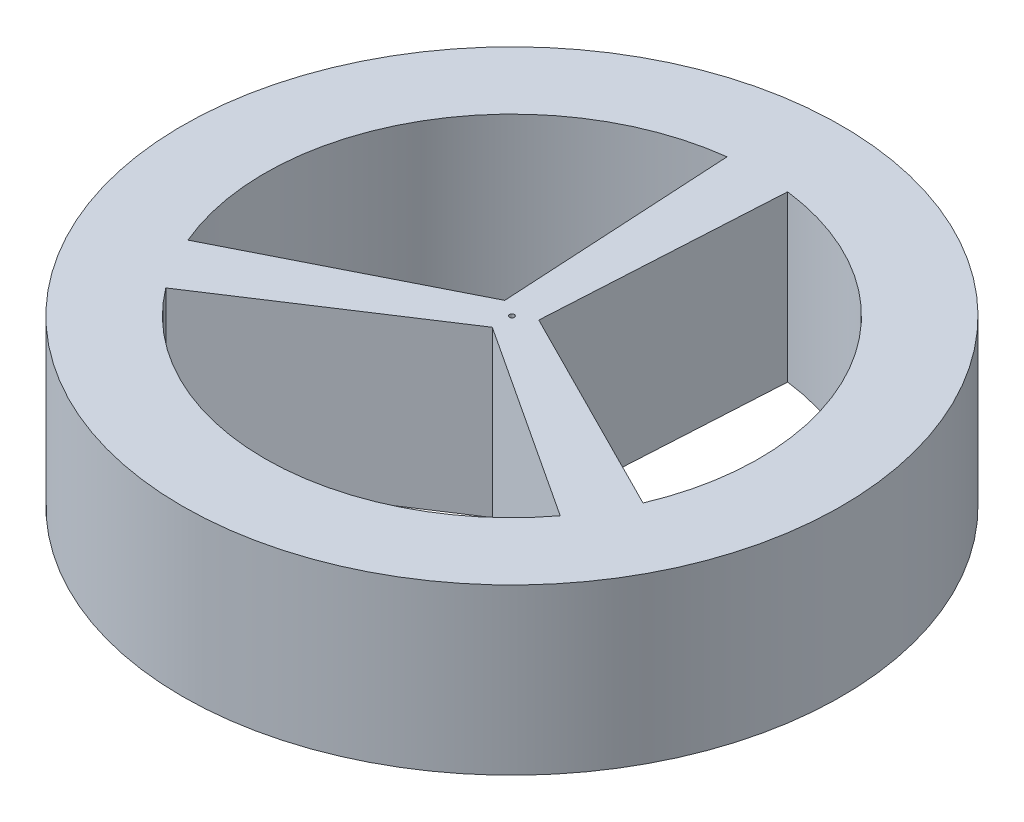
SolidWorks part; units mm, degrees
ref_plane "Plan de face" through (0, 0, 0) normal (0, 0, 1) x (1, 0, 0)
ref_plane "Plan de dessus" through (0, 0, 0) normal (0, 1, 0) x (1, 0, 0)
ref_plane "Plan de droite" through (0, 0, 0) normal (1, 0, 0) x (0, 0, -1)
sketch "Esquisse1" plane through (0, 0, 0) normal (0, 1, 0) x (1, 0, 0)
  line L0 (1.8429, 14.8864) -> (1, 0)
  line L1 (-1.834, 14.8875) -> (-1, 0)
  line L2 (13.8099, -5.8554) -> (0.5, 0.866)
  line L3 (11.9705, -9.0391) -> (-0.5, -0.866)
  line L4 (-11.9759, -9.032) -> (0.5, -0.866)
  line L5 (-13.8134, -5.8472) -> (-0.5, 0.866)
  circle A0 centre (0, 0) radius 20
  circle A1 centre (0, 0) radius 15
  circle A2 centre (0, 0) radius 0.15
  circle A3 centre (0, 0) radius 1
  arc A4 (-1.834, 14.8875) -> (1.8429, 14.8864) centre (0, 0) cw
  arc A5 (-1, 0) -> (1, 0) centre (0, 0) ccw
  point P21 (0, 0)
  dimension "D1" = 30
  dimension "D2" = 40
  dimension "D3" = 0.3
  dimension "D4" = 2
  dimension "D5" = 3
extrude "Boss.-Extru.2" add sketch "Esquisse1" along normal blind 10 contours L4 A3 L0 L2 L5 L1 L3 A2 | A3 L5 L1 | A3 L3 L4 | A3 L0 L2 | A3 L2 L0 A1 L1 L5 | A3 L4 L3 A1 L2 L0 | A3 L1 L5 A1 L4 L3 | A0 A1
